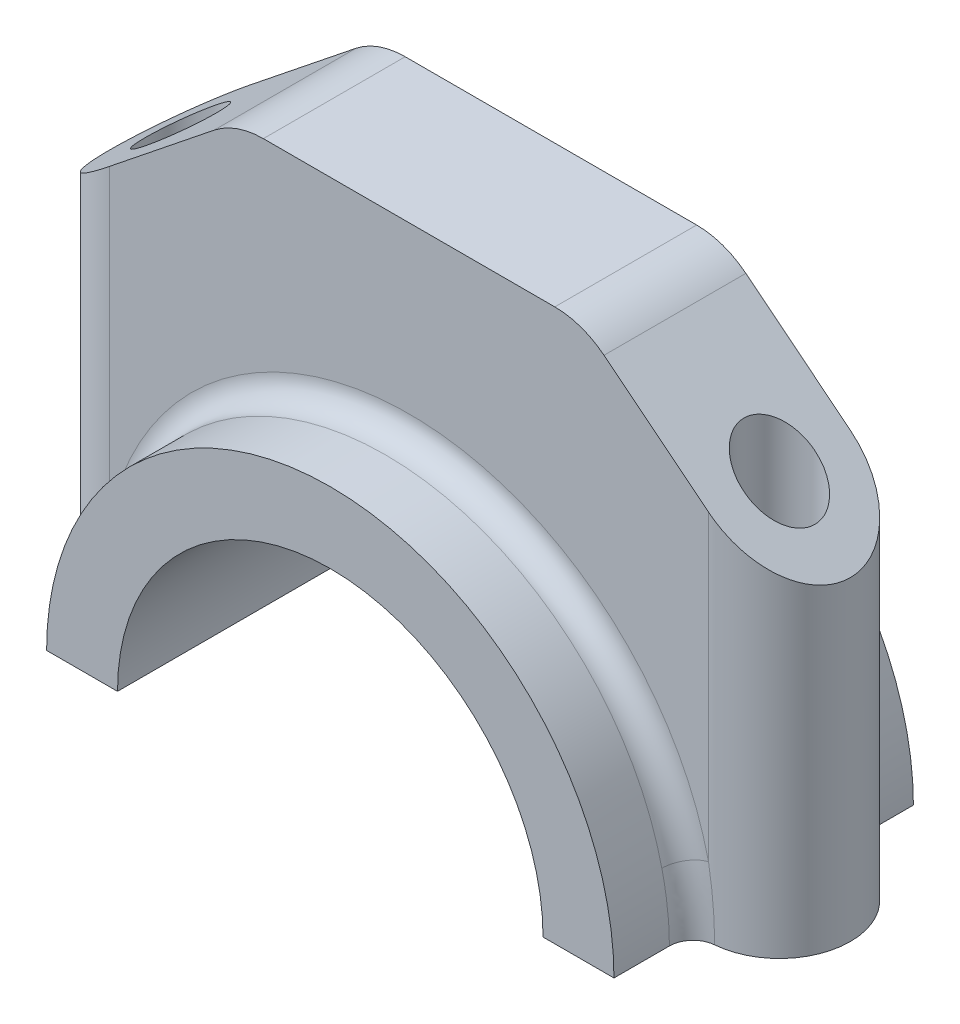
SolidWorks part; units mm, degrees
ref_plane "Front Plane" through (0, 0, 0) normal (0, 0, 1) x (1, 0, 0)
ref_plane "Top Plane" through (0, 0, 0) normal (0, 1, 0) x (1, 0, 0)
ref_plane "Right Plane" through (0, 0, 0) normal (1, 0, 0) x (0, 0, -1)
sketch "Sketch1" plane through (0, 0, 0) normal (0, 0, 1) x (1, 0, 0)
  line L0 (-36, 0) -> (-27, 0)
  line L1 (27, 0) -> (36, 0)
  arc A0 (36, 0) -> (-36, 0) centre (0, 0) ccw
  arc A1 (27, 0) -> (-27, 0) centre (0, 0) ccw
  dimension "D1" = 54
  dimension "D2" = 72
extrude "Boss-Extrude1" add sketch "Sketch1" along normal mid plane 38
ref_plane "Plane1" through (0, 60, 0) normal (0, -1, 0) x (-1, 0, 0)
sketch "Sketch2" plane through (0, 60, 0) normal (0, -1, 0) x (-1, 0, 0)
  line L0 (38, 0) -> (-38, 0) construction
  line L1 (38, -9) -> (-38, -9)
  line L2 (38, 9) -> (-38, 9)
  arc A0 (38, -9) -> (38, 9) centre (38, 0) ccw
  arc A1 (-38, 9) -> (-38, -9) centre (-38, 0) ccw
  point P2 (0, 0)
  dimension "D2" = 9
  dimension "D1" = 76
extrude "Boss-Extrude2" add sketch "Sketch2" along normal up to surface (60 mm away)
sketch "Sketch3" plane through (0, 0, -9) normal (0, 0, -1) x (-1, 0, 0)
  line L1 (-27, 0) -> (27, 0)
  line L2 (-27, 0) -> (27, 0)
  arc A1 (27, 0) -> (-27, 0) centre (0, 0) ccw
  arc A2 (27, 0) -> (-27, 0) centre (0, 0) ccw
  dimension "D1" = 0
extrude "Cut-Extrude1" cut sketch "Sketch3" against normal through all both
sketch "Sketch4" plane through (0, 0, 0) normal (0, -1, 0) x (1, 0, 0)
  circle A0 centre (38, 0) radius 4.5
  circle A1 centre (-38, 0) radius 4.5
  dimension "D1" = 9
  dimension "D2" = 9
extrude "Cut-Extrude2" cut sketch "Sketch4" against normal through all both
sketch "Sketch5" plane through (0, 0, 0) normal (0, 0, 1) x (1, 0, 0)
  line L0 (-47, 40) -> (-22, 60)
  line L1 (-47, 60) -> (-47, 0) construction
  line L2 (38, 60) -> (-38, 60) construction
  line L3 (-22, 60) -> (-47, 60)
  line L4 (-47, 60) -> (-47, 40)
  line L5 (0, 0) -> (0, 22.2918) construction
  line L6 (47, 60) -> (47, 40)
  line L7 (22, 60) -> (47, 60)
  line L8 (47, 40) -> (22, 60)
  dimension "D1" = 20
  dimension "D2" = 25
extrude "Cut-Extrude6" cut sketch "Sketch5" against normal through all both and the other way through all
fillet "Fillet1" radius 10 2 edges at (-22, 60, 0) (22, 60, 0)
fillet "Fillet2" radius 3 2 edges at (0, 36, -9) (0, 36, 9)
